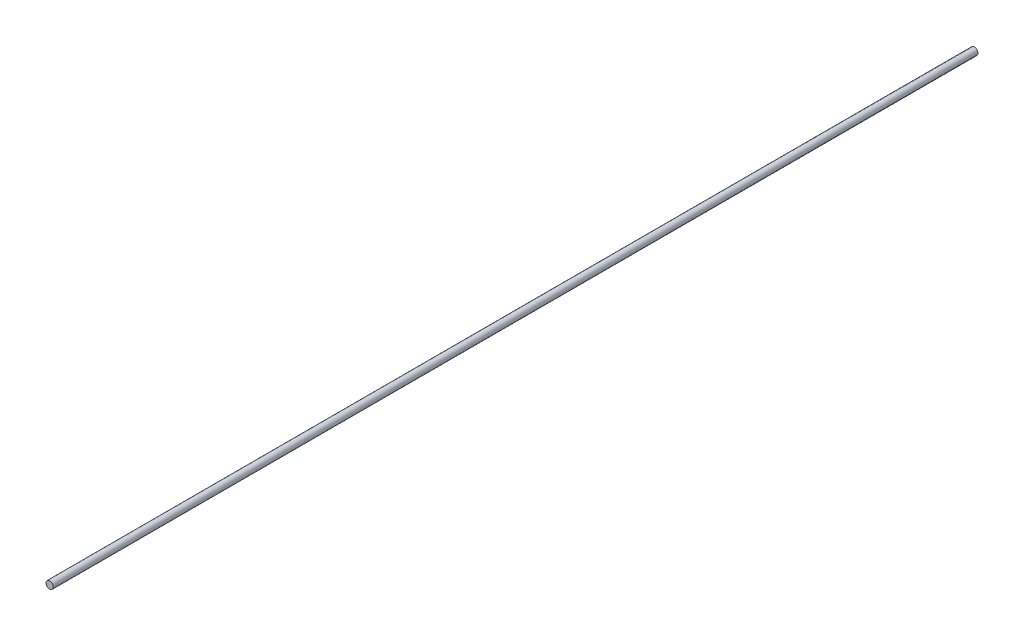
SolidWorks part; units mm, degrees
ref_plane "Front Plane" through (0, 0, 0) normal (0, 0, 1) x (1, 0, 0)
ref_plane "Top Plane" through (0, 0, 0) normal (0, 1, 0) x (1, 0, 0)
ref_plane "Right Plane" through (0, 0, 0) normal (1, 0, 0) x (0, 0, -1)
sketch "Sketch1" plane through (0, 0, 0) normal (0, 0, 1) x (1, 0, 0)
  circle A0 centre (0, 0) radius 4.7625
  dimension "D1" = 9.525
extrude "Boss-Extrude1" add sketch "Sketch1" along normal blind 1219.2
